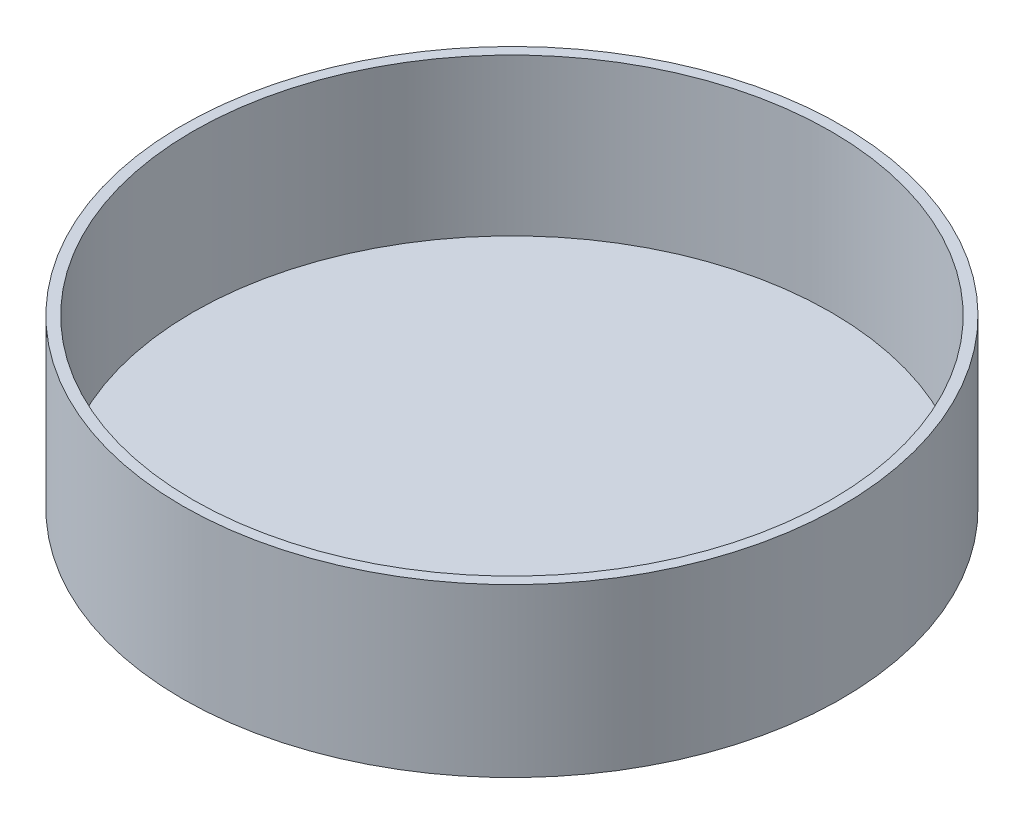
SolidWorks part; units mm, degrees
ref_plane "Front Plane" through (0, 0, 0) normal (0, 0, 1) x (1, 0, 0)
ref_plane "Top Plane" through (0, 0, 0) normal (0, 1, 0) x (1, 0, 0)
ref_plane "Right Plane" through (0, 0, 0) normal (1, 0, 0) x (0, 0, -1)
sketch "Sketch1" plane through (0, 0, 0) normal (0, 1, 0) x (1, 0, 0)
  circle A0 centre (0, 0) radius 26.765
  dimension "D1" = 53.53
extrude "Extrude1" add sketch "Sketch1" along normal blind 0.85
sketch "Sketch2" plane through (0, 0.85, 0) normal (0, 1, 0) x (-1, 0, 0)
  circle A0 centre (0, 0) radius 25.915
  circle A1 centre (0, 0) radius 26.765
  circle A2 centre (0, 0) radius 26.765
  dimension "D1" = 0
  dimension "D2" = 0.85
extrude "Extrude2" add sketch "Sketch2" along normal blind 12.72
